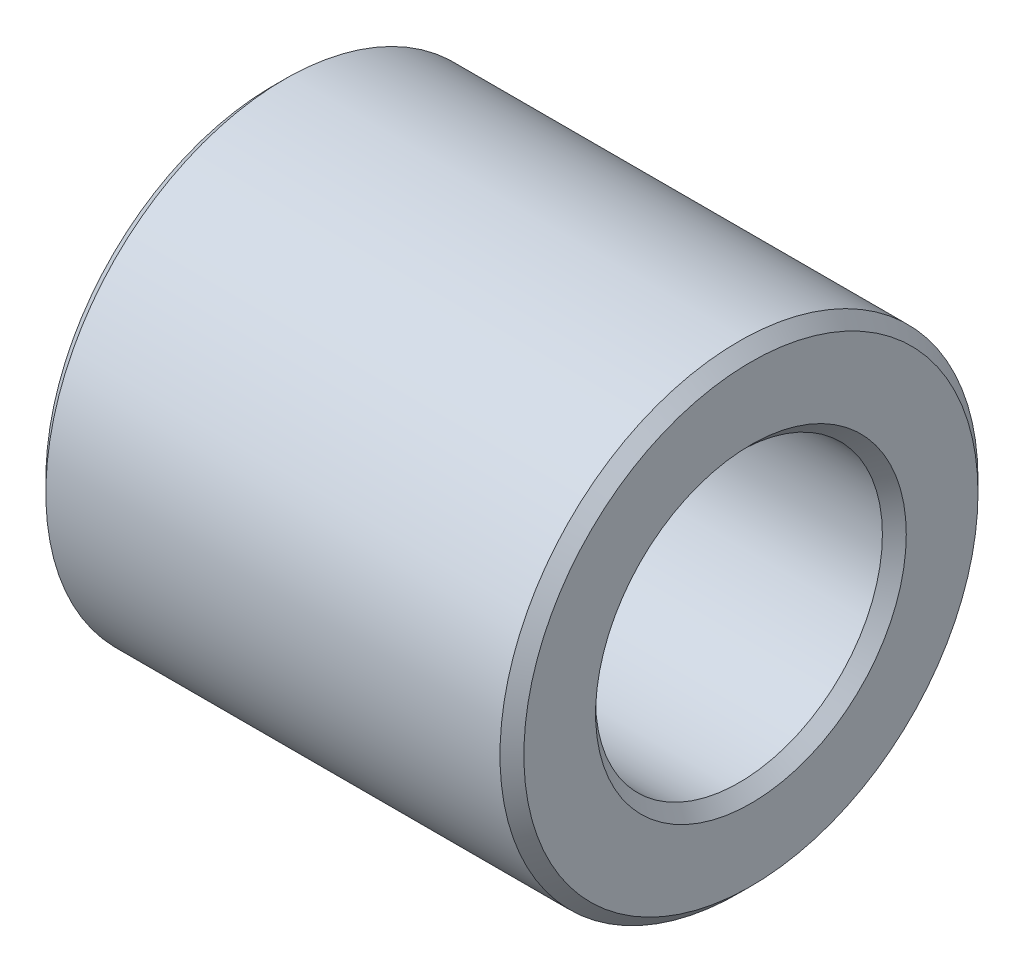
SolidWorks part; units mm, degrees
ref_plane "Спереди" through (0, 0, 0) normal (0, 0, 1) x (1, 0, 0)
ref_plane "Сверху" through (0, 0, 0) normal (0, 1, 0) x (1, 0, 0)
ref_plane "Справа" through (0, 0, 0) normal (1, 0, 0) x (0, 0, -1)
sketch "Эскиз1" plane through (0, 0, 0) normal (1, 0, 0) x (0, 0, -1)
  circle A0 centre (0, 0) radius 3
  circle A1 centre (0, 0) radius 5
  dimension "D1" = 6
  dimension "D2" = 10
extrude "Бобышка-Вытянуть1" add sketch "Эскиз1" along normal blind 10
chamfer "Фаска1" distance 0.25 angle 45 4 edges at (0, 0, -3) (10, 0, -3) (0, 0, -5) (10, 0, -5)
